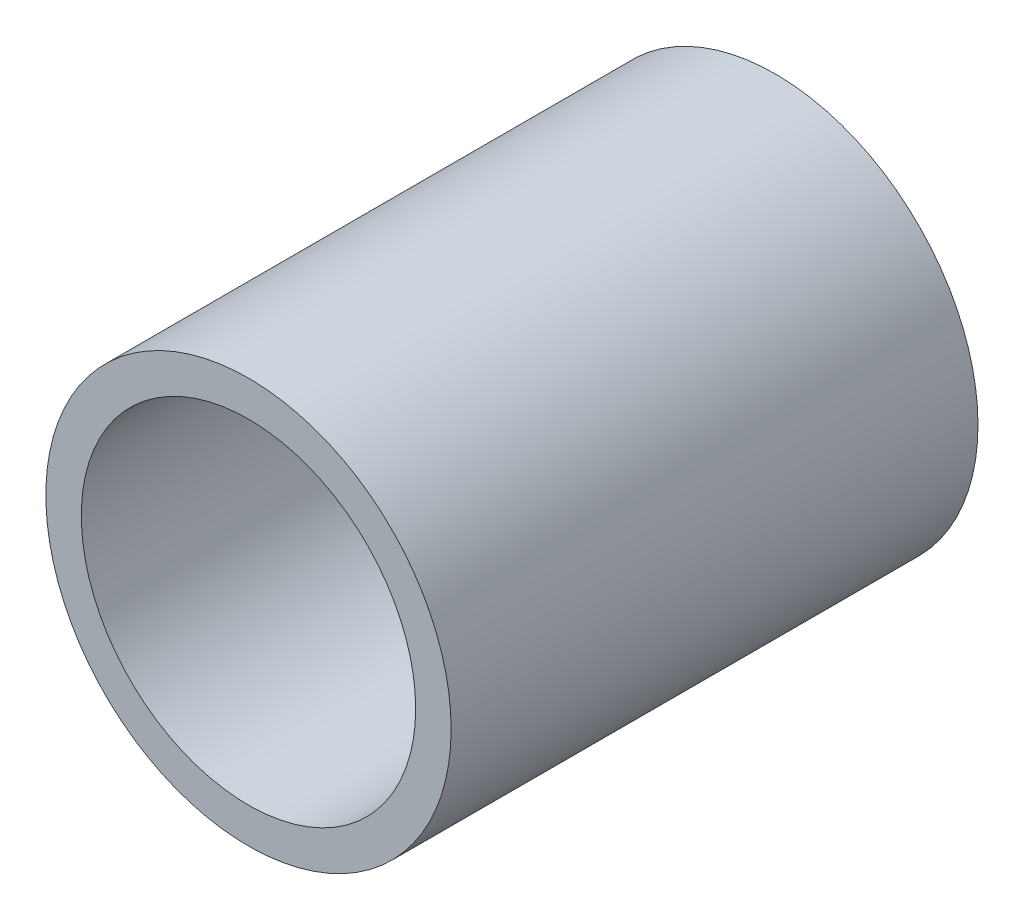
SolidWorks part; units mm, degrees
ref_plane "Face" through (0, 0, 0) normal (0, 0, 1) x (1, 0, 0)
ref_plane "Dessus" through (0, 0, 0) normal (0, 1, 0) x (1, 0, 0)
ref_plane "Droite" through (0, 0, 0) normal (1, 0, 0) x (0, 0, -1)
sketch "Esquisse1" plane through (0, 0, 0) normal (0, 0, 1) x (1, 0, 0)
  circle A0 centre (0, 0) radius 4
  circle A1 centre (0, 0) radius 3.3
  dimension "D1" = 6.6
  dimension "D2" = 8
extrude "Extrusion1" add sketch "Esquisse1" along normal blind 10.4
